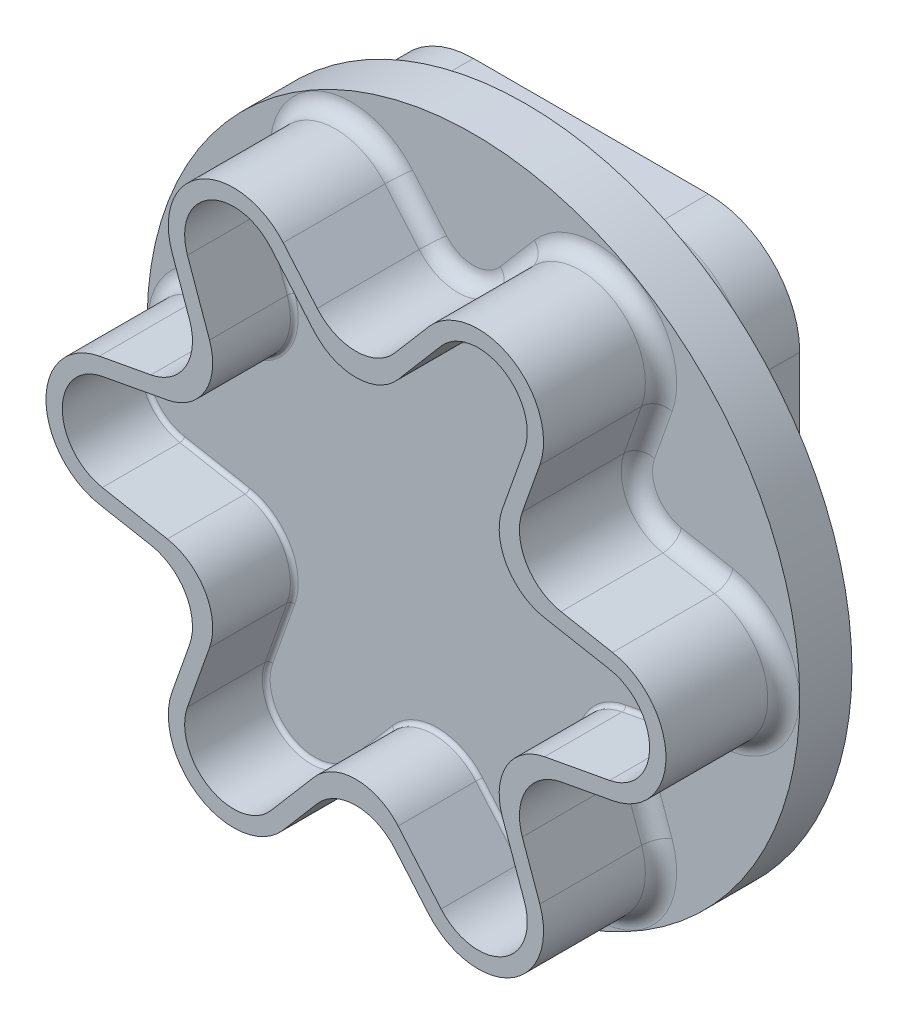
SolidWorks part; units mm, degrees
ref_plane "Front Plane" through (0, 0, 0) normal (0, 0, 1) x (1, 0, 0)
ref_plane "Top Plane" through (0, 0, 0) normal (0, 1, 0) x (1, 0, 0)
ref_plane "Right Plane" through (0, 0, 0) normal (1, 0, 0) x (0, 0, -1)
imported_body "Imported1"
hole_wizard "1/8 (0.125) Diameter Hole1" positions "Sketch1" profile "Sketch2" hole size "1/8" standard "ANSI Inch"
sketch "Sketch1" plane through (-40.64, 0, 0) normal (-1, 0, 0) x (0, 0, 1)
  line L1 (-45.72, -35.56) -> (-36.068, 35.56) construction
  point P0 (-40.894, 0)
  point P16 (-40.894, 0)
sketch "Sketch2" plane through (-40.64, 0, -40.894) normal (0, 1, 0) x (0, 0, 1)
  line L0 (0, 0) -> (0, 2.54)
  line L1 (0, 2.54) -> (1.5875, 2.54)
  line L2 (1.5875, 2.54) -> (1.5875, 0)
  line L5 (1.5875, 0) -> (0, 0)
  line L11 (0, -6.35) -> (0, 107.95) construction
  dimension "Thru Hole Dia." = 3.175
  dimension "Thru Hole Depth" = 2.54
